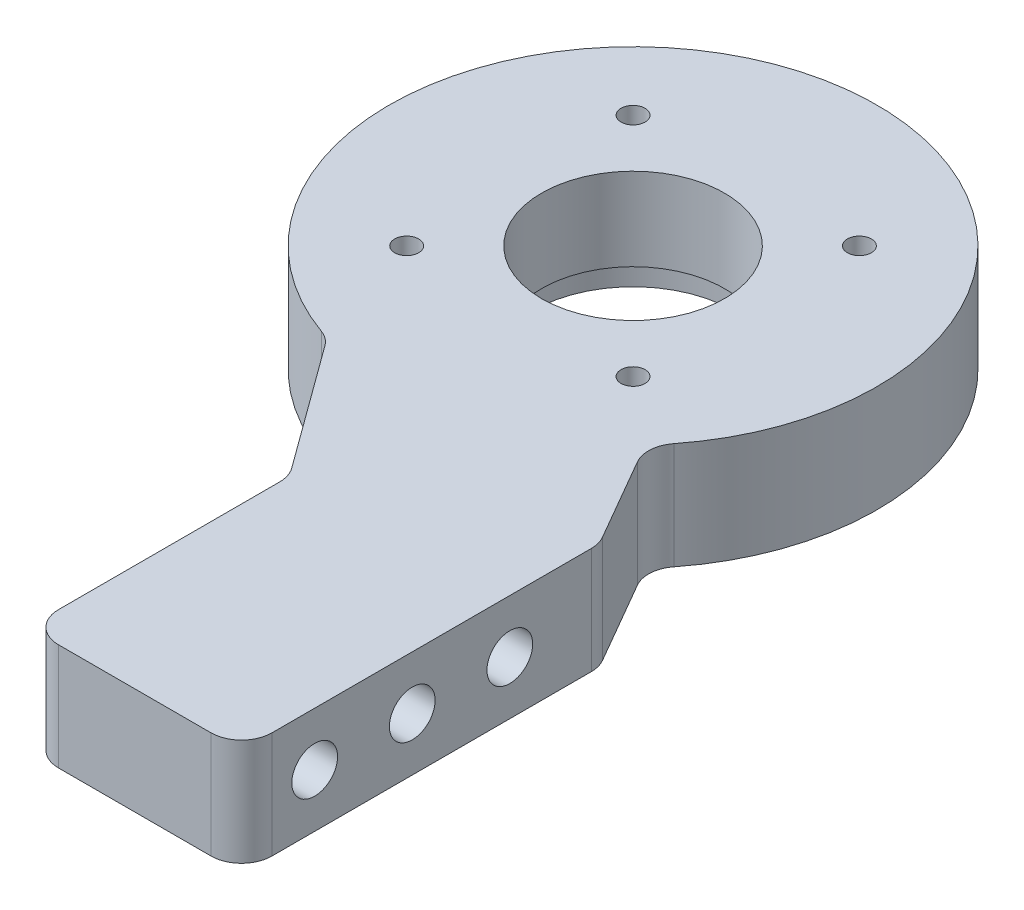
SolidWorks part; units mm, degrees
ref_plane "Front Plane" through (0, 0, 0) normal (0, 0, 1) x (1, 0, 0)
ref_plane "Top Plane" through (0, 0, 0) normal (0, 1, 0) x (1, 0, 0)
ref_plane "Right Plane" through (0, 0, 0) normal (1, 0, 0) x (0, 0, -1)
sketch "Sketch4" plane through (0, 0, 0) normal (0, 1, 0) x (1, 0, 0)
  line L3 (50.2301, -27.715) -> (37.1758, -5.1042)
  line L6 (50.2301, -80.3167) -> (50.2301, -27.715)
  line L8 (22.8392, -102.2561) -> (50.2301, -102.2561)
  line L9 (50.2301, -102.2561) -> (50.2301, -80.3167)
  line L10 (5.7801, -47.8055) -> (5.7801, -102.2561)
  line L11 (5.7801, -102.2561) -> (22.8392, -102.2561)
  line L12 (-15.2746, -18.9325) -> (5.7801, -47.8055)
  arc A1 (37.1758, -5.1042) -> (-15.2746, -18.9325) centre (0, 29.5167) ccw
  dimension "D2" = 50.8
  dimension "D1" = 44.45
  dimension "D3" = 26.1087
  dimension "D4" = 44.45
extrude "Boss-Extrude1" add sketch "Sketch4" along normal blind 22.225
sketch "Sketch5" plane through (0, 22.225, 0) normal (0, 1, 0) x (1, 0, 0)
  circle A2 centre (0, 29.5167) radius 19.05
  arc A3 (37.1758, -5.1042) -> (-15.2746, -18.9325) centre (0, 29.5167) ccw construction
  dimension "," = 38.1
extrude "Cut-Extrude1" cut sketch "Sketch5" against normal blind 38.1
sketch "Sketch9" plane through (0, 0, 0) normal (0, -1, 0) x (1, 0, 0)
  line L1 (-23.57, -5.9467) -> (23.57, -5.9467) construction
  line L2 (-23.57, -5.9467) -> (-23.57, -53.0867) construction
  line L3 (-23.57, -53.0867) -> (23.57, -53.0867) construction
  line L4 (23.57, -5.9467) -> (23.57, -53.0867) construction
  line L5 (-23.57, -5.9467) -> (23.57, -53.0867) construction
  line L6 (-23.57, -53.0867) -> (23.57, -5.9467) construction
  circle A0 centre (-23.57, -5.9467) radius 2.5
  circle A1 centre (23.57, -5.9467) radius 2.5
  circle A2 centre (-23.57, -53.0867) radius 2.5
  circle A3 centre (23.57, -53.0867) radius 2.5
  point P0 (0, -29.5167)
  dimension "D3" = 5
  dimension "D4" = 5
  dimension "D5" = 5
  dimension "D6" = 5
  dimension "D1" = 47.14
  dimension "D2" = 47.14
extrude "Cut-Extrude4" cut sketch "Sketch9" against normal blind 42.672
sketch "Sketch12" plane through (50.2301, 0, 0) normal (1, 0, 0) x (0, 0, -1)
  line L0 (-102.2561, 22.225) -> (-102.2561, 0) construction
  line L1 (-102.2561, 22.225) -> (-102.2561, 0) construction
  circle A0 centre (-87.0161, 11.1125) radius 4.7625
  circle A1 centre (-66.6961, 11.1125) radius 4.7625
  circle A2 centre (-46.3761, 11.1125) radius 4.7625
  point P4 (-102.2561, 11.1125)
  dimension "D1" = 9.525
  dimension "D2" = 15.24
  dimension "D3" = 3
extrude "Cut-Extrude5" cut sketch "Sketch12" against normal blind 31.75
fillet "Fillet1" radius 6.35 6 edges at (-15.2746, 11.1125, 18.9325) (5.7801, 11.1125, 47.8055) (5.7801, 11.1125, 102.2561) (50.2301, 11.1125, 102.2561) (50.2301, 11.1125, 27.715) (37.1758, 11.1125, 5.1042)
sketch "Sketch13" plane through (0, 0, 0) normal (0, -1, 0) x (1, 0, 0)
  circle A0 centre (0, -29.5167) radius 21
  dimension "D1" = 42
extrude "Cut-Extrude6" cut sketch "Sketch13" against normal blind 5
